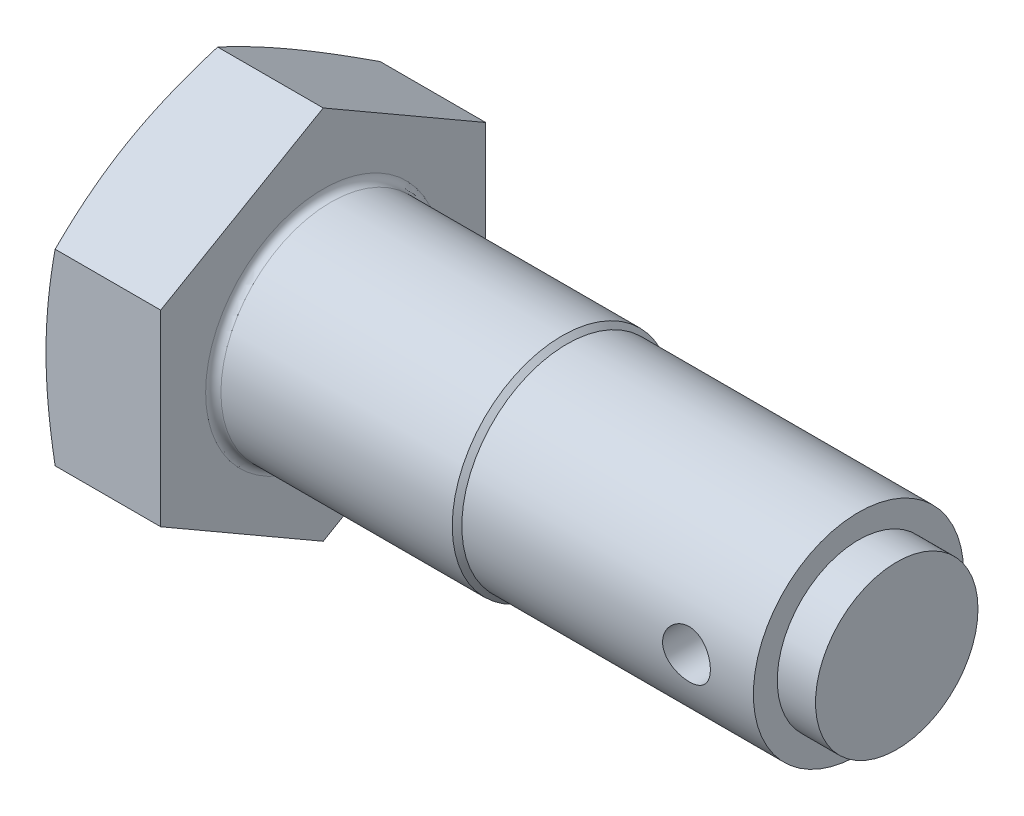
SolidWorks part; units mm, degrees
ref_plane "Front" through (0, 0, 0) normal (0, 0, 1) x (1, 0, 0)
ref_plane "Top" through (0, 0, 0) normal (0, 1, 0) x (1, 0, 0)
ref_plane "Right" through (0, 0, 0) normal (1, 0, 0) x (0, 0, -1)
sketch "Sketch1" plane through (0, 0, 0) normal (1, 0, 0) x (0, 0, -1)
  line L1 (0, -19.6299) -> (17, -9.815)
  line L2 (17, -9.815) -> (17, 9.815)
  line L3 (17, 9.815) -> (0, 19.6299)
  line L4 (0, 19.6299) -> (-17, 9.815)
  line L5 (-17, 9.815) -> (-17, -9.815)
  line L6 (-17, -9.815) -> (0, -19.6299)
  circle A0 centre (0, 0) radius 17 construction
  dimension "s" = 34
extrude "BaseHead" add sketch "Sketch1" along normal blind 12
sketch "Sketch2" plane through (12, 0, 0) normal (1, 0, 0) x (0, 0, -1)
  circle A0 centre (0, 0) radius 11.5
  dimension "ds" = 23
extrude "Basebody1" add sketch "Sketch2" along normal blind 25
sketch "Sketch4" plane through (37, 0, 0) normal (1, 0, 0) x (0, 0, -1)
  circle A0 centre (0, 0) radius 11
  dimension "d" = 22
extrude "Basebody2" add sketch "Sketch4" along normal offset from surface (35 mm away) 60
sketch "Sketch5" plane through (72, 0, 0) normal (1, 0, 0) x (0, 0, -1)
  circle A0 centre (0, 0) radius 8.5
  dimension "dp" = 17
extrude "Cut-Extrude1" cut sketch "Sketch5" against normal blind 4 flip side to cut
sketch "Sketch6" plane through (0, 0, 0) normal (0, 0, 1) x (1, 0, 0)
  line L0 (0, 19.6299) -> (0.9572, 19.6299)
  line L1 (0.9572, 19.6299) -> (0, 17)
  line L3 (0, 17) -> (0, 19.6299)
  line L4 (-1.5773, 0) -> (3.1205, 0) construction
  line L6 (12, 19.6299) -> (0, 19.6299) construction
  dimension "D1" = 20
  dimension "D2" = 34
revolve "HeadChamfer" cut sketch "Sketch6" angle 360 about L4
fillet "HeadFillet" radius 0.8 1 edges at (12, 0, 11.5)
chamfer "Chamfer1" distance 0.5 angle 45 1 edges at (37, 0, -11)
sketch "Sketch7" plane through (0, 0, 0) normal (0, 0, 1) x (1, 0, 0)
  line L1 (12, 19.6299) -> (12, 9.815) construction
  line L4 (68, 0) -> (37.5, 0) construction
  circle A0 centre (61, 0) radius 2.5
  dimension "d1" = 5
  dimension "lh" = 49
extrude "Hole" cut sketch "Sketch7" against normal through all and the other way through all
equation "\"D1@Chamfer1\" =  ( \"ds@Sketch2\" - \"d@Sketch4\" )  / 2"
equation "\"D2@Sketch6\" = \"s@Sketch1\""
